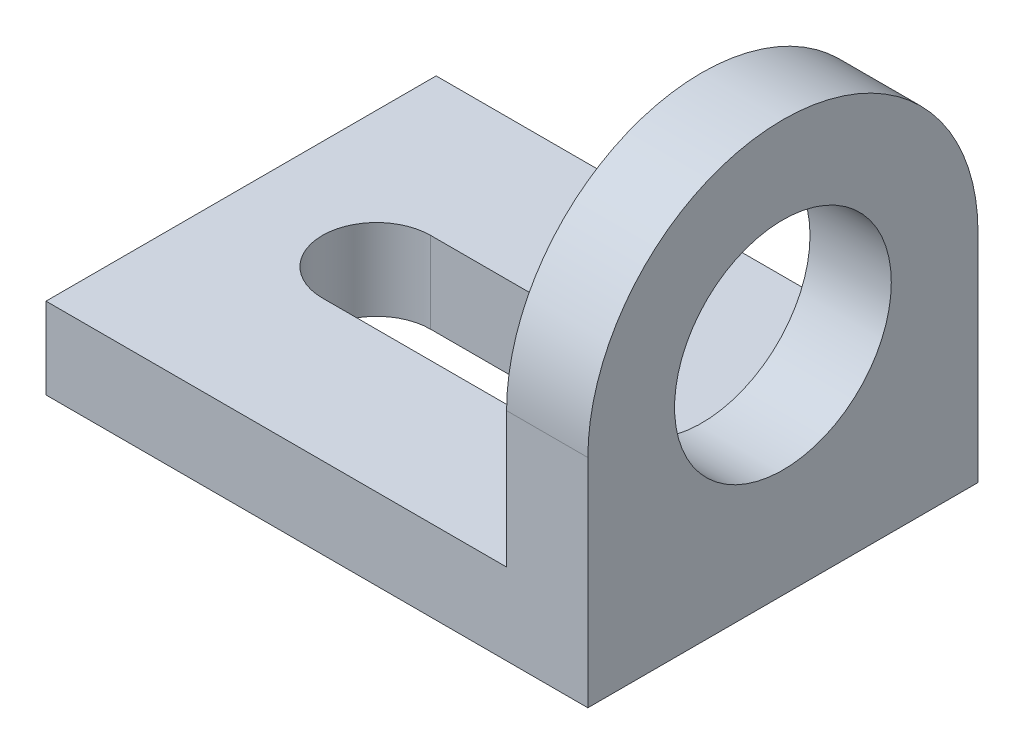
SolidWorks part; units mm, degrees
ref_plane "前视基准面" through (0, 0, 0) normal (0, 0, 1) x (1, 0, 0)
ref_plane "上视基准面" through (0, 0, 0) normal (0, 1, 0) x (1, 0, 0)
ref_plane "右视基准面" through (0, 0, 0) normal (1, 0, 0) x (0, 0, -1)
sketch "草图1" plane through (0, 0, 0) normal (0, 1, 0) x (1, 0, 0)
  line L0 (0, 0) -> (64.7151, 0) construction
  line L1 (-100, 36) -> (0, 36)
  line L2 (-100, 36) -> (-100, -36)
  line L3 (-100, -36) -> (0, -36)
  line L4 (0, 36) -> (0, -36)
  line L5 (-75, 10) -> (-35, 10)
  line L6 (-35, -10) -> (-75, -10)
  arc A0 (-35, 10) -> (-35, -10) centre (-35, 0) cw
  arc A1 (-75, -10) -> (-75, 10) centre (-75, 0) cw
extrude "拉伸1" add sketch "草图1" along normal blind 15
sketch "草图2" plane through (0, 0, 0) normal (1, 0, 0) x (0, 0, -1)
  line L0 (-36, 15) -> (-36, 40)
  line L1 (36, 40) -> (36, 15)
  line L2 (36, 15) -> (-36, 15)
  arc A0 (-36, 40) -> (36, 40) centre (0, 40) cw
  circle A1 centre (0, 40) radius 20
extrude "拉伸2" add sketch "草图2" against normal blind 15
